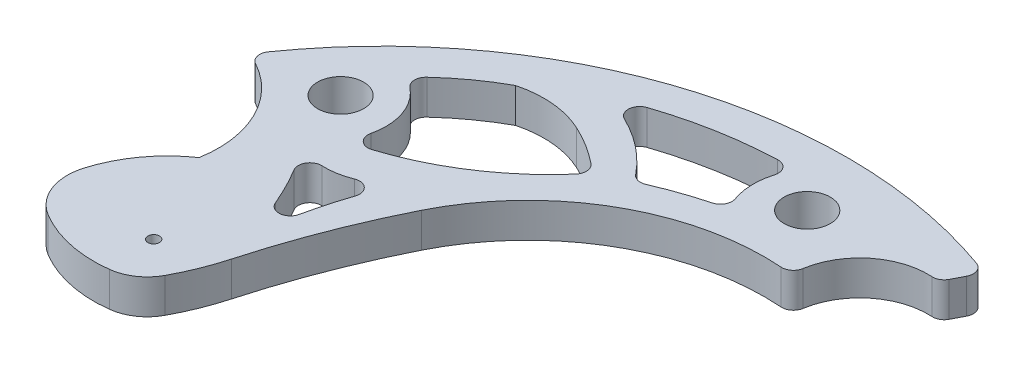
SolidWorks part; units mm, degrees
ref_plane "Plan de face" through (0, 0, 0) normal (0, 0, 1) x (1, 0, 0)
ref_plane "Plan de dessus" through (0, 0, 0) normal (0, 1, 0) x (1, 0, 0)
ref_plane "Plan de droite" through (0, 0, 0) normal (1, 0, 0) x (0, 0, -1)
sketch "Esquisse1" plane through (0, 0, 0) normal (0, 1, 0) x (1, 0, 0)
  line L1 (-838.335, -246.9439) -> (-171.6683, -246.9439) construction
  line L2 (0, 0) -> (83.6, 0) construction
  line L3 (0, 0) -> (0, 119.5424) construction
  circle A0 centre (0, 0) radius 0.5
  arc A1 (-1.2453, 23.1053) -> (4.1342, 27.2252) centre (15.0702, 7.3737) cw
  arc A2 (4.1342, 27.2252) -> (9.9598, 26.7004) centre (6.3207, 18.901) cw
  arc A3 (9.9598, 26.7004) -> (14.0534, 23.9602) centre (3.1407, 12.0855) cw
  arc A4 (14.0534, 23.9602) -> (0.6703, 15.6265) centre (-4.5773, 38.9662) cw
  arc A5 (0.6703, 15.6265) -> (-1.2453, 23.1053) centre (-3.4633, 18.5524) ccw
  arc A6 (8.9452, 30.3121) -> (16.498, 25.1352) centre (5.5793, 17.3034) cw
  arc A7 (8.9452, 30.3121) -> (22.6503, 33.0382) centre (22.3333, -1.1823) cw
  arc A8 (22.6503, 33.0382) -> (22.6503, 27.2252) centre (27.4531, 30.1317) ccw
  arc A9 (22.6503, 27.2252) -> (16.498, 25.1352) centre (29.4188, -2.7992) ccw
  circle A10 centre (-2.6983, 18.901) radius 2
  circle A11 centre (26.1522, 30.4959) radius 2
  arc A12 (-0.525, 13.3979) -> (7.1434, 16.02) centre (2.0098, 18.5091) ccw
  arc A13 (-0.525, 13.3979) -> (3.8275, 4.1639) centre (-21.7653, -2.2566) cw
  arc A14 (3.8275, 4.1639) -> (7.1434, 16.02) centre (38.2916, 0.9168) cw
  line B0 (37.1724, 30.8556) -> (38.5209, 33.4671)
  arc B1 (30.2611, 25.0085) -> (9.4297, 13.7897) centre (27.8052, 4.619) ccw
  arc B2 (4.8564, 1.893) -> (9.4297, 13.7897) centre (68.9784, -15.9293) cw
  arc B3 (4.8564, 1.893) -> (3.1999, -2.2271) centre (-14.4276, 7.2529) cw
  arc B4 (-4.1639, 8.1015) -> (-8.3677, 2.3214) centre (1.9348, -0.7526) ccw
  arc B5 (-4.1639, 8.1015) -> (-9.768, 18.0603) centre (-13.0537, 9.6552) ccw
  arc B6 (-9.768, 18.0603) -> (38.5209, 33.4671) centre (23.9208, -4.151) cw
  arc B7 (30.2611, 25.0085) -> (37.1724, 30.8556) centre (36.1902, 25.0084) cw
  arc B8 (-8.3677, 2.3214) -> (-6.4021, -2.7426) centre (-4.1239, 1.0552) ccw
  arc B9 (-6.4021, -2.7426) -> (0.3644, -4.1706) centre (-0.9502, 6.3457) ccw
  arc B10 (0.3644, -4.1706) -> (3.1999, -2.2271) centre (-0.1004, -0.4522) ccw
  dimension "D1" = 1
  dimension "D2" = 83.6
  dimension "D3" = 4
  dimension "D4" = 4
sketch_block_instance "Bloc1-1"
sketch_block "Bloc1"
extrude "Boss.-Extru.1" add sketch "Esquisse1" along normal blind 3
fillet "Congé1" radius 1 3 edges at (3.8275, 1.5, -4.1639) (7.1434, 1.5, -16.02) (-0.525, 1.5, -13.3979)
fillet "Congé2" radius 1 3 edges at (14.0534, 1.5, -23.9602) (0.6703, 1.5, -15.6265) (-1.2453, 1.5, -23.1053)
fillet "Congé3" radius 1 4 edges at (22.6503, 1.5, -27.2252) (16.498, 1.5, -25.1352) (22.6503, 1.5, -33.0382) (8.9452, 1.5, -30.3121)
fillet "Congé4" radius 1 4 edges at (-9.768, 1.5, -18.0603) (38.5209, 1.5, -33.4671) (37.1724, 1.5, -30.8556) (30.2611, 1.5, -25.0085)
